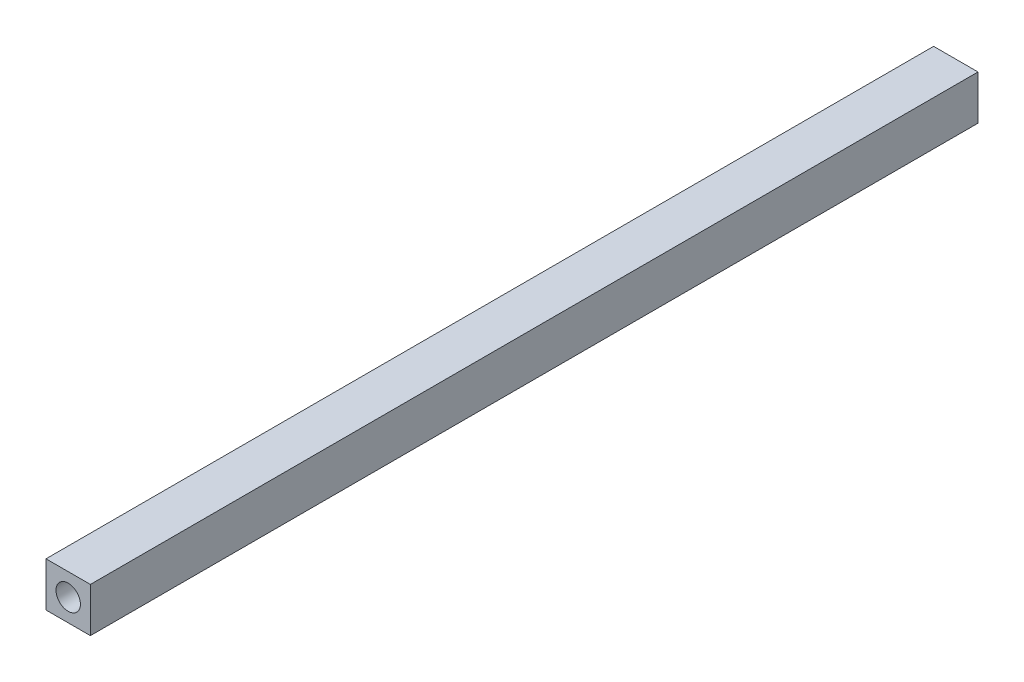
SolidWorks part; units mm, degrees
ref_plane "Plan de face" through (0, 0, 0) normal (0, 0, 1) x (1, 0, 0)
ref_plane "Plan de dessus" through (0, 0, 0) normal (0, 1, 0) x (1, 0, 0)
ref_plane "Plan de droite" through (0, 0, 0) normal (1, 0, 0) x (0, 0, -1)
sketch "Esquisse1" plane through (0, 0, 0) normal (0, 0, 1) x (1, 0, 0)
  line L1 (0, 0) -> (6, 0)
  line L2 (0, 0) -> (0, 6)
  line L3 (0, 6) -> (6, 6)
  line L4 (6, 0) -> (6, 6)
  dimension "D1" = 6
  dimension "D2" = 6
extrude "Boss.-Extru.1" add sketch "Esquisse1" against normal blind 120
sketch "Esquisse7" plane through (0, 0, 0) normal (0, 0, 1) x (1, 0, 0)
  line L0 (3, 6.1375) -> (3, -0.3319) construction
  line L1 (-0.2503, 3) -> (6.6702, 3) construction
  dimension "D1" = 3
  dimension "D2" = 3
hole_wizard "Trou taraudé M43" positions "Esquisse3D1" profile "Esquisse10" tap size "M4" standard "ISO"
sketch3d "Esquisse3D1"
  line L0 (3, 6.1375, 0) -> (3, -0.3319, 0) construction
  line L1 (-0.2503, 3, 0) -> (6.6702, 3, 0) construction
  point P0 (3, 3, 0)
sketch "Esquisse10" plane through (3, 3, 0) normal (1, 0, 0) x (0, -1, 0)
  line L0 (0, 0) -> (0, 12.4914)
  line L1 (0, 12.4914) -> (1.65, 11.5)
  line L2 (1.65, 11.5) -> (1.65, 0)
  line L5 (1.65, 0) -> (0, 0)
  line L10 (0, 12.4914) -> (-1.65, 11.5) construction
  line L11 (0, -6.35) -> (0, 107.95) construction
  dimension "Diamètre du trou pour taraudage" = 3.3
  dimension "Profondeur du trou pour taraudage" = 11.5
  dimension "Angle de pointe" = 118
sketch "Esquisse12" plane through (0, 0, -120) normal (0, 0, -1) x (-1, 0, 0)
  line L0 (-6.2418, 3) -> (0.2503, 3) construction
  line L1 (0.2503, 3) -> (-6.6702, 3) construction
  line L2 (-3, 6.1375) -> (-3, -0.2385) construction
  line L3 (-3, 6.1375) -> (-3, -0.3319) construction
hole_wizard "Trou taraudé M45" positions "Esquisse14" profile "Esquisse13" tap size "M4" standard "ISO"
sketch "Esquisse14" plane through (0, 0, -120) normal (0, 0, -1) x (-1, 0, 0)
  line L0 (-6.2418, 3) -> (0.2503, 3) construction
  point P0 (-2.9957, 3)
sketch "Esquisse13" plane through (2.9957, 3, -120) normal (1, 0, 0) x (0, 1, 0)
  line L0 (0, 0) -> (0, 12.4914)
  line L1 (0, 12.4914) -> (1.65, 11.5)
  line L2 (1.65, 11.5) -> (1.65, 0)
  line L5 (1.65, 0) -> (0, 0)
  line L10 (0, 12.4914) -> (-1.65, 11.5) construction
  line L11 (0, -6.35) -> (0, 107.95) construction
  dimension "Diamètre du trou pour taraudage" = 3.3
  dimension "Profondeur du trou pour taraudage" = 11.5
  dimension "Angle de pointe" = 118
